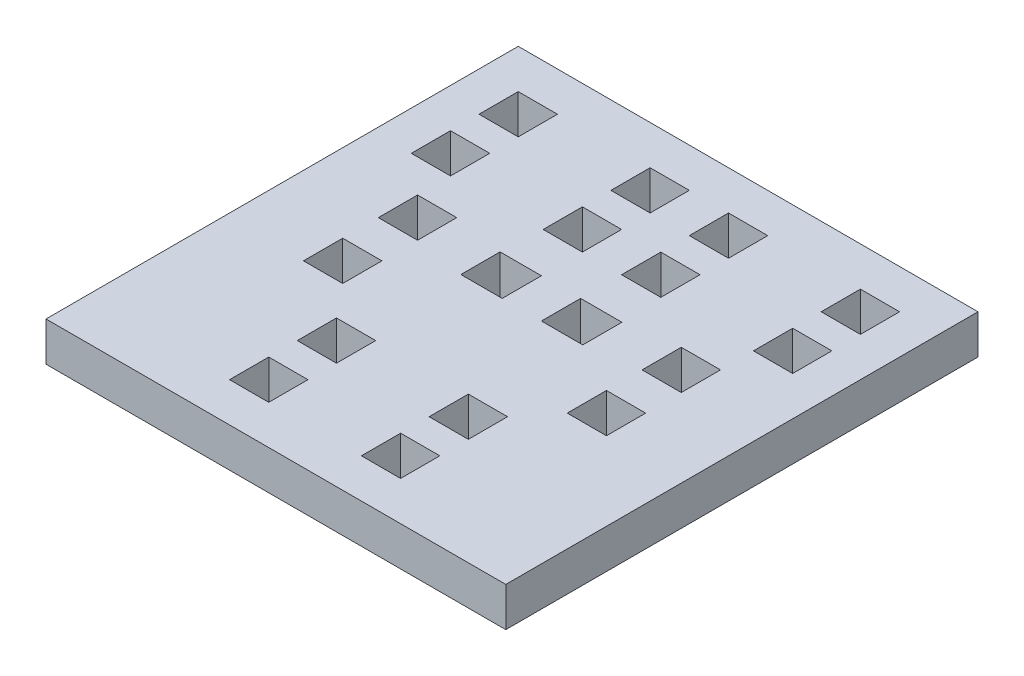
SolidWorks part; units mm, degrees
ref_plane "Front Plane" through (0, 0, 0) normal (0, 0, 1) x (1, 0, 0)
ref_plane "Top Plane" through (0, 0, 0) normal (0, 1, 0) x (1, 0, 0)
ref_plane "Right Plane" through (0, 0, 0) normal (1, 0, 0) x (0, 0, -1)
sketch "Sketch2" plane through (0, 0, 0) normal (0, 1, 0) x (1, 0, 0)
  line L0 (0, 0) -> (0, 66.25) construction
  line L1 (0, 66.25) -> (-64.5, 66.25) construction
  line L2 (-64.5, 66.25) -> (-64.5, 0) construction
  line L3 (-64.5, 0) -> (0, 0) construction
  line L4 (-64.5, 66.25) -> (-64.5, 60.75) construction
  line L5 (-64.5, 60.75) -> (0, 60.75) construction
  line L6 (-32.25, 0) -> (-32.25, 40) construction
  line L7 (-23.7, 40) -> (-40.8, 40) construction
  line L8 (-64.5, 66.25) -> (0, 66.25)
  line L9 (-53.5, 41.125) -> (-53.5, 25.125) construction
  line L10 (0, 66.25) -> (0, 0)
  line L11 (0, 0) -> (-64.5, 0)
  line L12 (-64.5, 0) -> (-64.5, 66.25)
  line L13 (-59, 60.75) -> (-53.5, 60.75)
  line L14 (-53.5, 60.75) -> (-53.5, 55.25)
  line L15 (-53.5, 55.25) -> (-59, 55.25)
  line L16 (-11, 41.125) -> (-11, 25.125) construction
  line L17 (-59, 55.25) -> (-59, 60.75)
  line L18 (-59, 51.25) -> (-53.5, 51.25)
  line L19 (-53.5, 51.25) -> (-53.5, 45.75)
  line L20 (-11, 30.625) -> (-11, 35.625) construction
  line L21 (-53.5, 45.75) -> (-59, 45.75)
  line L22 (-59, 45.75) -> (-59, 51.25)
  line L23 (-40.8, 40) -> (-40.8, 34.5) construction
  line L24 (-40.8, 34.5) -> (-23.7, 34.5) construction
  line L25 (-23.7, 34.5) -> (-23.7, 40) construction
  line L26 (-29.5, 40) -> (-35, 40) construction
  line L27 (-35, 40) -> (-35, 34.5) construction
  line L28 (-35, 34.5) -> (-29.5, 34.5) construction
  line L42 (-29.5, 34.5) -> (-29.5, 40) construction
  line L43 (-64.5, 33.125) -> (-32.25, 33.125) construction
  line L45 (0, 60.75) -> (0, 53.25) construction
  line L46 (0, 53.25) -> (-64.5, 53.25) construction
  line L47 (-64.5, 0) -> (-64.5, 5.5) construction
  line L48 (-64.5, 5.5) -> (0, 5.5) construction
  line L49 (0, 5.5) -> (0, 13) construction
  line L50 (0, 13) -> (-64.5, 13) construction
  line L51 (-64.5, 13) -> (-59, 13) construction
  line L52 (-59, 13) -> (-59, 45.75) construction
  line L53 (-59, 53.25) -> (-35, 53.25) construction
  line L54 (-32.25, 13) -> (-32.25, 53.25) construction
  line L55 (-35, 13) -> (-29.5, 13) construction
  line L56 (-32.25, 33.125) -> (0, 33.125) construction
  line L57 (-29.5, 53.25) -> (-5.5, 53.25) construction
  line L58 (-5.5, 53.25) -> (-5.5, 13) construction
  line L59 (-59, 45.75) -> (-59, 60.75) construction
  line L60 (-59, 60.75) -> (-53.5, 60.75) construction
  line L61 (-5.5, 53.25) -> (-5.5, 60.75) construction
  line L62 (-53.5, 60.75) -> (-53.5, 45.75) construction
  line L63 (-53.5, 45.75) -> (-59, 45.75) construction
  line L64 (-5.5, 60.75) -> (-11, 60.75) construction
  line L65 (-11, 60.75) -> (-11, 45.75) construction
  line L66 (-11, 45.75) -> (-5.5, 45.75) construction
  line L67 (-59, 45.75) -> (-59, 51.25) construction
  line L68 (-59, 51.25) -> (-53.5, 51.25) construction
  line L69 (-53.5, 60.75) -> (-53.5, 55.25) construction
  line L70 (-53.5, 55.25) -> (-59, 55.25) construction
  line L71 (-11, 60.75) -> (-11, 55.25) construction
  line L72 (-11, 55.25) -> (-5.5, 55.25) construction
  line L73 (-11, 45.75) -> (-11, 51.25) construction
  line L74 (-11, 51.25) -> (-5.5, 51.25) construction
  line L75 (-35, 45.75) -> (-40.5, 45.75) construction
  line L76 (-40.5, 45.75) -> (-40.5, 60.75) construction
  line L77 (-40.5, 60.75) -> (-35, 60.75) construction
  line L78 (-35, 60.75) -> (-35, 45.75) construction
  line L79 (-35, 45.75) -> (-35, 51.25) construction
  line L80 (-35, 51.25) -> (-40.5, 51.25) construction
  line L81 (-40.5, 60.75) -> (-40.5, 55.25) construction
  line L82 (-40.5, 55.25) -> (-35, 55.25) construction
  line L83 (-29.5, 60.75) -> (-29.5, 45.75) construction
  line L84 (-29.5, 45.75) -> (-24, 45.75) construction
  line L85 (-24, 45.75) -> (-24, 60.75) construction
  line L86 (-24, 60.75) -> (-29.5, 60.75) construction
  line L87 (-29.5, 60.75) -> (-29.5, 55.25) construction
  line L88 (-29.5, 55.25) -> (-24, 55.25) construction
  line L89 (-24, 55.25) -> (-24, 51.25) construction
  line L90 (-24, 51.25) -> (-29.5, 51.25) construction
  line L91 (-20.25, 13) -> (-44.25, 13) construction
  line L92 (-44.25, 20.5) -> (-44.25, 5.5) construction
  line L93 (-44.25, 5.5) -> (-38.75, 5.5) construction
  line L94 (-38.75, 5.5) -> (-38.75, 20.5) construction
  line L95 (-38.75, 20.5) -> (-44.25, 20.5) construction
  line L96 (-20.25, 20.5) -> (-20.25, 5.5) construction
  line L97 (-20.25, 5.5) -> (-25.75, 5.5) construction
  line L98 (-25.75, 5.5) -> (-25.75, 20.5) construction
  line L99 (-25.75, 20.5) -> (-20.25, 20.5) construction
  line L100 (-20.25, 20.5) -> (-20.25, 15) construction
  line L101 (-20.25, 15) -> (-25.75, 15) construction
  line L102 (-53.5, 41.125) -> (-48, 41.125) construction
  line L103 (-38.75, 15) -> (-44.25, 15) construction
  line L104 (-44.25, 0) -> (-44.25, 11) construction
  line L105 (-44.25, 11) -> (-38.75, 11) construction
  line L106 (-48, 41.125) -> (-48, 25.125) construction
  line L107 (-25.75, 11) -> (-20.25, 11) construction
  line L108 (-48, 25.125) -> (-53.5, 25.125) construction
  line L109 (-53.5, 30.625) -> (-48, 30.625) construction
  line L110 (-53.5, 35.625) -> (-48, 35.625) construction
  line L111 (-11, 41.125) -> (-16.5, 41.125) construction
  line L112 (-16.5, 41.125) -> (-16.5, 25.125) construction
  line L113 (-16.5, 25.125) -> (-11, 25.125) construction
  line L114 (-11, 30.625) -> (-16.5, 30.625) construction
  line L115 (-16.5, 35.625) -> (-11, 35.625) construction
  line L116 (-53.5, 41.125) -> (-48, 41.125)
  line L117 (-48, 41.125) -> (-48, 35.625)
  line L118 (-48, 35.625) -> (-53.5, 35.625)
  line L119 (-53.5, 35.625) -> (-53.5, 41.125)
  line L120 (-53.5, 30.625) -> (-48, 30.625)
  line L121 (-48, 30.625) -> (-48, 25.125)
  line L122 (-48, 25.125) -> (-53.5, 25.125)
  line L123 (-53.5, 25.125) -> (-53.5, 30.625)
  line L124 (-40.5, 60.75) -> (-35, 60.75)
  line L125 (-35, 60.75) -> (-35, 55.25)
  line L126 (-35, 55.25) -> (-40.5, 55.25)
  line L127 (-40.5, 55.25) -> (-40.5, 60.75)
  line L128 (-40.5, 51.25) -> (-35, 51.25)
  line L129 (-35, 51.25) -> (-35, 45.75)
  line L130 (-35, 45.75) -> (-40.5, 45.75)
  line L131 (-40.5, 45.75) -> (-40.5, 51.25)
  line L132 (-29.5, 60.75) -> (-24, 60.75)
  line L133 (-24, 60.75) -> (-24, 55.25)
  line L134 (-24, 55.25) -> (-29.5, 55.25)
  line L135 (-29.5, 55.25) -> (-29.5, 60.75)
  line L136 (-29.5, 51.25) -> (-24, 51.25)
  line L137 (-24, 51.25) -> (-24, 45.75)
  line L138 (-24, 45.75) -> (-29.5, 45.75)
  line L139 (-29.5, 45.75) -> (-29.5, 51.25)
  line L140 (-11, 60.75) -> (-5.5, 60.75)
  line L141 (-5.5, 60.75) -> (-5.5, 55.25)
  line L142 (-5.5, 55.25) -> (-11, 55.25)
  line L143 (-11, 55.25) -> (-11, 60.75)
  line L144 (-11, 51.25) -> (-5.5, 51.25)
  line L145 (-5.5, 51.25) -> (-5.5, 45.75)
  line L146 (-5.5, 45.75) -> (-11, 45.75)
  line L147 (-11, 45.75) -> (-11, 51.25)
  line L148 (-40.8, 40) -> (-35, 40)
  line L149 (-35, 40) -> (-35, 34.5)
  line L150 (-35, 34.5) -> (-40.8, 34.5)
  line L151 (-40.8, 34.5) -> (-40.8, 40)
  line L152 (-29.5, 40) -> (-23.7, 40)
  line L153 (-23.7, 40) -> (-23.7, 34.5)
  line L154 (-23.7, 34.5) -> (-29.5, 34.5)
  line L155 (-29.5, 34.5) -> (-29.5, 40)
  line L156 (-16.5, 41.125) -> (-11, 41.125)
  line L157 (-11, 41.125) -> (-11, 35.625)
  line L158 (-11, 35.625) -> (-16.5, 35.625)
  line L159 (-16.5, 35.625) -> (-16.5, 41.125)
  line L160 (-16.5, 30.625) -> (-11, 30.625)
  line L161 (-11, 30.625) -> (-11, 25.125)
  line L162 (-11, 25.125) -> (-16.5, 25.125)
  line L163 (-16.5, 25.125) -> (-16.5, 30.625)
  line L164 (-44.25, 20.5) -> (-38.75, 20.5)
  line L165 (-38.75, 20.5) -> (-38.75, 15)
  line L166 (-38.75, 15) -> (-44.25, 15)
  line L167 (-44.25, 15) -> (-44.25, 20.5)
  line L168 (-44.25, 11) -> (-38.75, 11)
  line L169 (-38.75, 11) -> (-38.75, 5.5)
  line L170 (-38.75, 5.5) -> (-44.25, 5.5)
  line L171 (-44.25, 5.5) -> (-44.25, 11)
  line L172 (-25.75, 20.5) -> (-20.25, 20.5)
  line L173 (-20.25, 20.5) -> (-20.25, 15)
  line L174 (-20.25, 15) -> (-25.75, 15)
  line L175 (-25.75, 15) -> (-25.75, 20.5)
  line L176 (-25.75, 11) -> (-20.25, 11)
  line L177 (-20.25, 11) -> (-20.25, 5.5)
  line L178 (-20.25, 5.5) -> (-25.75, 5.5)
  line L179 (-25.75, 5.5) -> (-25.75, 11)
  point P9 (-32.25, 40)
  point P31 (-32.25, 40)
  point P94 (-32.25, 13)
  point P96 (-44.25, 13)
  point P101 (-20.25, 13)
  point P111 (-44.25, 5.5)
  dimension "D6" = 15
  dimension "D7" = 5.5
  dimension "D11" = 40.25
  dimension "D2" = 12.7
  dimension "D3" = 16
  dimension "D4" = 5.5
  dimension "D5" = 5.5
  dimension "D8" = 5.5
  dimension "D9" = 15
  dimension "D10" = 5.5
  dimension "D12" = 24
  dimension "D13" = 5.5
  dimension "D14" = 17.1
  dimension "D15" = 5.5
extrude "Boss-Extrude1" add sketch "Sketch2" along normal blind 5.5
